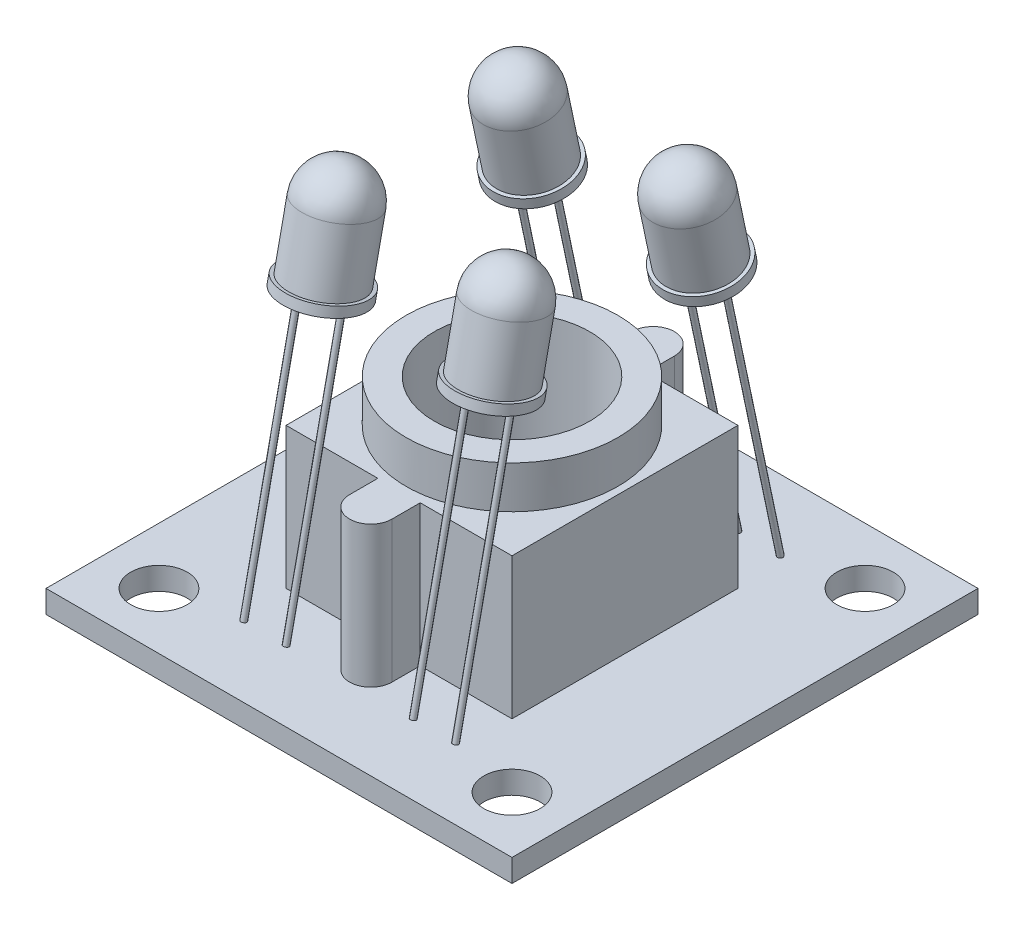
SolidWorks part; units mm, degrees
ref_plane "Front Plane" through (0, 0, 0) normal (0, 0, 1) x (1, 0, 0)
ref_plane "Top Plane" through (0, 0, 0) normal (0, 1, 0) x (1, 0, 0)
ref_plane "Right Plane" through (0, 0, 0) normal (1, 0, 0) x (0, 0, -1)
sketch "Sketch1" plane through (0, 0, 0) normal (0, 1, 0) x (1, 0, 0)
  line L1 (-16.5, -16.5) -> (16.5, -16.5)
  line L2 (-16.5, -16.5) -> (-16.5, 16.5)
  line L3 (-16.5, 16.5) -> (16.5, 16.5)
  line L4 (16.5, -16.5) -> (16.5, 16.5)
  line L5 (-16.5, -16.5) -> (16.5, 16.5) construction
  line L6 (-16.5, 16.5) -> (16.5, -16.5) construction
  circle A0 centre (-12.5, 12.5) radius 2
  circle A1 centre (12.5, 12.5) radius 2
  circle A2 centre (12.5, -12.5) radius 2
  circle A3 centre (-12.5, -12.5) radius 2
  point P0 (0, 0)
  dimension "D2" = 4
  dimension "D3" = 4
  dimension "D4" = 4
  dimension "D5" = 4
  dimension "D6" = 4
  dimension "D7" = 4
  dimension "D8" = 4
  dimension "D9" = 4
  dimension "D1" = 33
extrude "Boss-Extrude1" add sketch "Sketch1" along normal blind 1.6
sketch "Sketch2" plane through (0, 1.6, 0) normal (0, 1, 0) x (1, 0, 0)
  line L1 (-8, -8) -> (8, -8)
  line L2 (-8, -8) -> (-8, 8)
  line L3 (-8, 8) -> (8, 8)
  line L4 (8, -8) -> (8, 8)
  line L5 (-8, -8) -> (8, 8) construction
  line L6 (-8, 8) -> (8, -8) construction
  point P0 (0, 0)
  dimension "D1" = 16
extrude "Boss-Extrude2" add sketch "Sketch2" along normal blind 10
sketch "Sketch3" plane through (0, 11.6, 0) normal (0, 1, 0) x (1, 0, 0)
  line L2 (8, 8) -> (-8, 8) construction
  line L3 (-8, -8) -> (8, -8) construction
  line L4 (-1.5, -10) -> (-1.5, 10)
  line L5 (1.5, -10) -> (1.5, 10)
  arc A0 (1.5, 10) -> (-1.5, 10) centre (0, 10) ccw
  arc A1 (-1.5, -10) -> (1.5, -10) centre (0, -10) ccw
  dimension "D1" = 3
  dimension "D3" = 2
  dimension "D4" = 3
  dimension "D2" = 2
extrude "Boss-Extrude3" add sketch "Sketch3" against normal up to next
sketch "Sketch4" plane through (0, 11.6, 0) normal (0, 1, 0) x (1, 0, 0)
  circle A0 centre (0, 0) radius 7.5
  circle A1 centre (0, 0) radius 5.5
extrude "Boss-Extrude4" add sketch "Sketch4" along normal blind 3
sketch "Sketch5" plane through (0, 11.6, 0) normal (0, 1, 0) x (1, 0, 0)
  circle A1 centre (0, 0) radius 5.5
  circle A2 centre (0, 0) radius 5.5
  dimension "D1" = 0
extrude "Cut-Extrude1" cut sketch "Sketch5" against normal blind 8
ref_plane "Plane1" through (-7.5, 0, 0) normal (-1, 0, 0) x (0, 0, 1)
sketch "Sketch6" plane through (-7.5, 0, 0) normal (-1, 0, 0) x (0, 0, 1)
  line L0 (-11.5, 1.6) -> (-7.3574, 21.1663)
  line L1 (-16.5, 1.6) -> (16.5, 1.6) construction
  line L2 (-16.5, 1.6) -> (-16.5, 0) construction
  dimension "D1" = 5
  dimension "D2" = 20
ref_plane "Plane2" through (-7.5, 21.1663, -7.3574) normal (0, 0.9783, 0.2071) x (1, 0, 0)
sketch "Sketch7" plane through (-7.5, 21.1663, -7.3574) normal (0, 0.9783, 0.2071) x (1, 0, 0)
  circle A0 centre (0, 0) radius 0.2
  dimension "D1" = 0.4
sweep "Sweep1" add profiles "Sketch7" path "Sketch6"
pattern_linear "LPattern1" count 2 spacing 3 along (1, 0, 0) of "Sweep1"
sketch "Sketch8" plane through (0, 18.7673, 3.9735) normal (0, 0.9783, 0.2071) x (1, 0, 0)
  line L0 (-7.5, 11.582) -> (-4.5, 11.582)
  circle A0 centre (-6, 11.582) radius 2.75
  dimension "D1" = 5.5
extrude "Boss-Extrude7" add sketch "Sketch8" against normal blind 0.7
sketch "Sketch9" plane through (0, 18.7673, 3.9735) normal (0, 0.9783, 0.2071) x (1, 0, 0)
  circle A0 centre (-6, 11.582) radius 2.5
extrude "Boss-Extrude8" add sketch "Sketch9" along normal blind 7
fillet "Fillet1" radius 2.5 1 edges at (-6, 27.4966, -3.4617)
pattern_linear "LPattern2" count 2 spacing 12 along (1, 0, 0) of "Sweep1", "LPattern1", "Boss-Extrude7", "Boss-Extrude8", "Fillet1"
mirror "Mirror1" about plane through (0, 0, 0) normal (0, 0, 1) of "LPattern2", "Fillet1", "Boss-Extrude8", "Boss-Extrude7", "LPattern1", "Sweep1"
